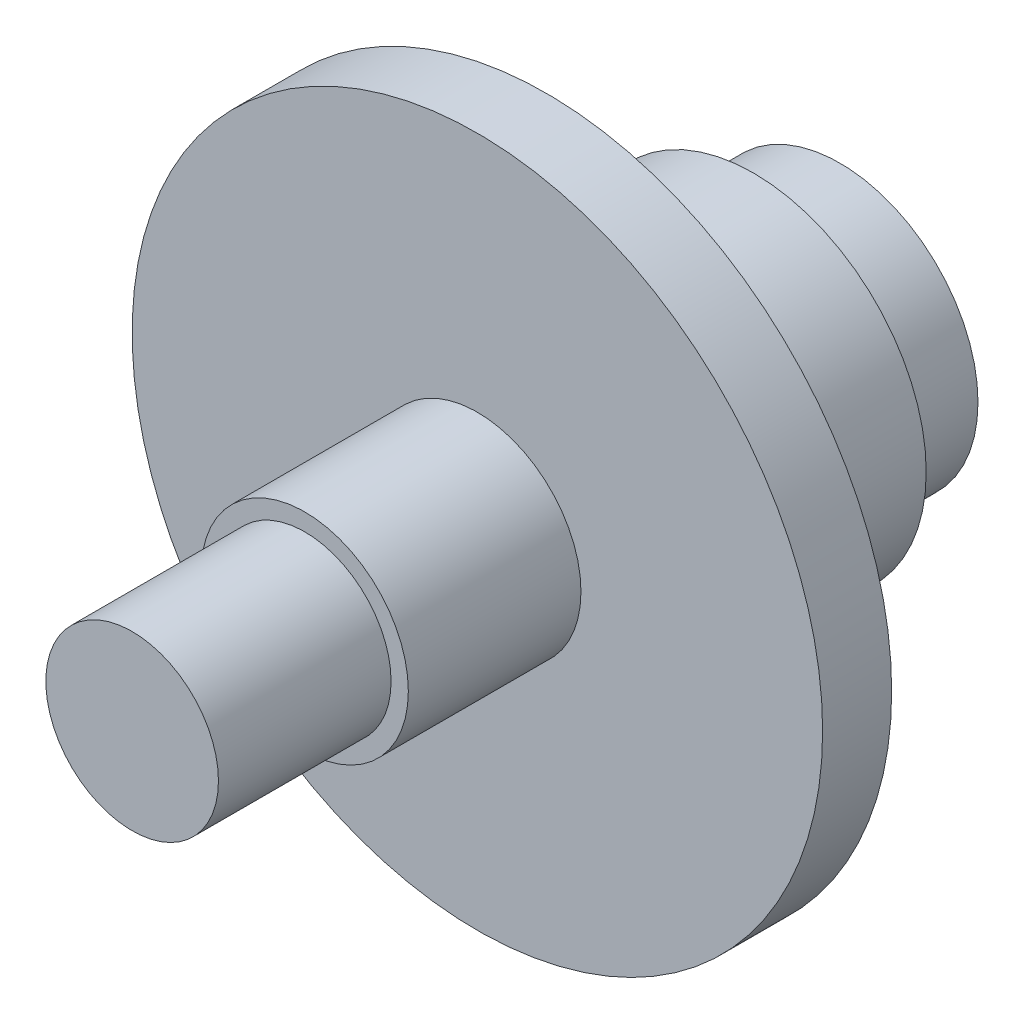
SolidWorks part; units mm, degrees
ref_plane "Plan de face" through (0, 0, 0) normal (0, 0, 1) x (1, 0, 0)
ref_plane "Plan de dessus" through (0, 0, 0) normal (0, 1, 0) x (1, 0, 0)
ref_plane "Plan de droite" through (0, 0, 0) normal (1, 0, 0) x (0, 0, -1)
sketch "Esquisse1" plane through (0, 0, 0) normal (0, 0, 1) x (1, 0, 0)
  circle A0 centre (0, 0) radius 4
  dimension "D1" = 8
extrude "Extrusion1" add sketch "Esquisse1" along normal blind 2.5
sketch "Esquisse2" plane through (0, 0, 2.5) normal (0, 0, 1) x (1, 0, 0)
  circle A0 centre (0, 0) radius 5
  dimension "D1" = 10
extrude "Extrusion2" add sketch "Esquisse2" along normal blind 6
sketch "Esquisse3" plane through (0, 0, 8.5) normal (0, 0, 1) x (1, 0, 0)
  circle A0 centre (0, 0) radius 10
  dimension "D1" = 20
extrude "Extrusion3" add sketch "Esquisse3" along normal blind 2
sketch "Esquisse4" plane through (0, 0, 10.5) normal (0, 0, 1) x (1, 0, 0)
  circle A0 centre (0, 0) radius 3
  dimension "D1" = 6
extrude "Extrusion4" add sketch "Esquisse4" along normal blind 5
sketch "Esquisse5" plane through (0, 0, 15.5) normal (0, 0, 1) x (1, 0, 0)
  circle A0 centre (0, 0) radius 2.5
  dimension "D1" = 5
extrude "Extrusion5" add sketch "Esquisse5" along normal blind 5
hole_wizard "Trou taraudé M61" positions "Esquisse7" profile "Esquisse6" tap size "M6" standard "ISO"
sketch "Esquisse7" plane through (0, 0, 0) normal (0, 0, -1) x (-1, 0, 0)
  point P0 (0, 0)
sketch "Esquisse6" plane through (0, 0, 0) normal (1, 0, 0) x (0, 1, 0)
  line L0 (0, 0) -> (0, 7.5022)
  line L1 (0, 7.5022) -> (2.5, 6)
  line L2 (2.5, 6) -> (2.5, 0)
  line L5 (2.5, 0) -> (0, 0)
  line L10 (0, 7.5022) -> (-2.5, 6) construction
  line L11 (0, -6.35) -> (0, 107.95) construction
  dimension "Diamètre du trou pour taraudage" = 5
  dimension "Profondeur du trou pour taraudage" = 6
  dimension "Angle de pointe" = 118
